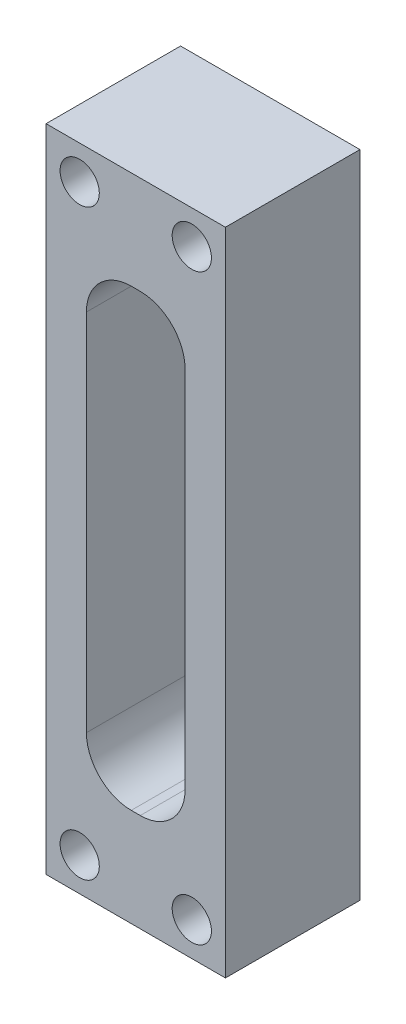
SolidWorks part; units mm, degrees
ref_plane "Front" through (0, 0, 0) normal (0, 0, 1) x (1, 0, 0)
ref_plane "Top" through (0, 0, 0) normal (0, 1, 0) x (1, 0, 0)
ref_plane "Right" through (0, 0, 0) normal (1, 0, 0) x (0, 0, -1)
sketch "Sketch1" plane through (0, 0, 0) normal (0, 0, 1) x (1, 0, 0)
  line L0 (0, 0) -> (-6.985, 0) construction
  line L1 (-12.7, 46.0375) -> (12.7, 46.0375)
  line L2 (-12.7, 46.0375) -> (-12.7, -46.0375)
  line L3 (-12.7, -46.0375) -> (12.7, -46.0375)
  line L4 (12.7, 46.0375) -> (12.7, -46.0375)
  line L5 (-0.635, 32.1437) -> (0.635, 32.1437)
  line L6 (-6.985, 25.7937) -> (-6.985, -25.7937)
  line L8 (6.985, 25.7937) -> (6.985, -25.7937)
  line L9 (-0.635, -32.1437) -> (0.635, -32.1437)
  arc A0 (-6.985, 25.7937) -> (-0.635, 32.1437) centre (-0.635, 25.7937) cw
  arc A1 (6.985, 25.7937) -> (0.635, 32.1437) centre (0.635, 25.7937) ccw
  arc A2 (0.635, -32.1437) -> (6.985, -25.7937) centre (0.635, -25.7937) ccw
  arc A3 (-6.985, -25.7937) -> (-0.635, -32.1437) centre (-0.635, -25.7937) ccw
  point P19 (6.985, -32.1437)
  dimension "D7" = 64.2874
  dimension "D6" = 6.35
  dimension "D1" = 25.4
  dimension "D2" = 92.075
  dimension "D3" = 46.0375
  dimension "D4" = 12.7
  dimension "D5" = 13.97
  dimension "D8" = 6.985
extrude "Extrude1" add sketch "Sketch1" along normal mid plane 19.05
hole_wizard "7/32 (0.21875) Diameter Hole1" positions "Sketch3" profile "Sketch2" hole size "7/32" standard "Ansi Inch"
sketch "Sketch3" plane through (0, 0, 9.525) normal (0, 0, 1) x (1, 0, 0)
  point P0 (-7.9375, 41.275)
  point P1 (7.9375, 41.275)
  point P3 (7.9375, -41.275)
  point P5 (-7.9375, -41.275)
  dimension "D1" = 82.55
  dimension "D2" = 15.875
  dimension "D3" = 7.9375
  dimension "D4" = 41.275
sketch "Sketch2" plane through (-7.9375, 41.275, 9.525) normal (1, 0, 0) x (0, -1, 0)
  line L0 (0, 0) -> (0, 19.05)
  line L1 (0, 19.05) -> (2.7781, 19.05)
  line L2 (2.7781, 19.05) -> (2.7781, 0)
  line L5 (2.7781, 0) -> (0, 0)
  line L11 (0, -6.35) -> (0, 107.95) construction
  dimension "Thru Hole Dia." = 5.5562
  dimension "Thru Hole Depth" = 19.05
equation "\"D3@Sketch1\" = \"D2@Sketch1\"/2"
equation "\"D4@Sketch1\" = \"D1@Sketch1\"/2"
equation "\"D8@Sketch1\" = \"D5@Sketch1\"/2"
equation "\"D3@Sketch3\" = \"D2@Sketch3\"/2"
equation "\"D4@Sketch3\" = \"D1@Sketch3\"/2"
